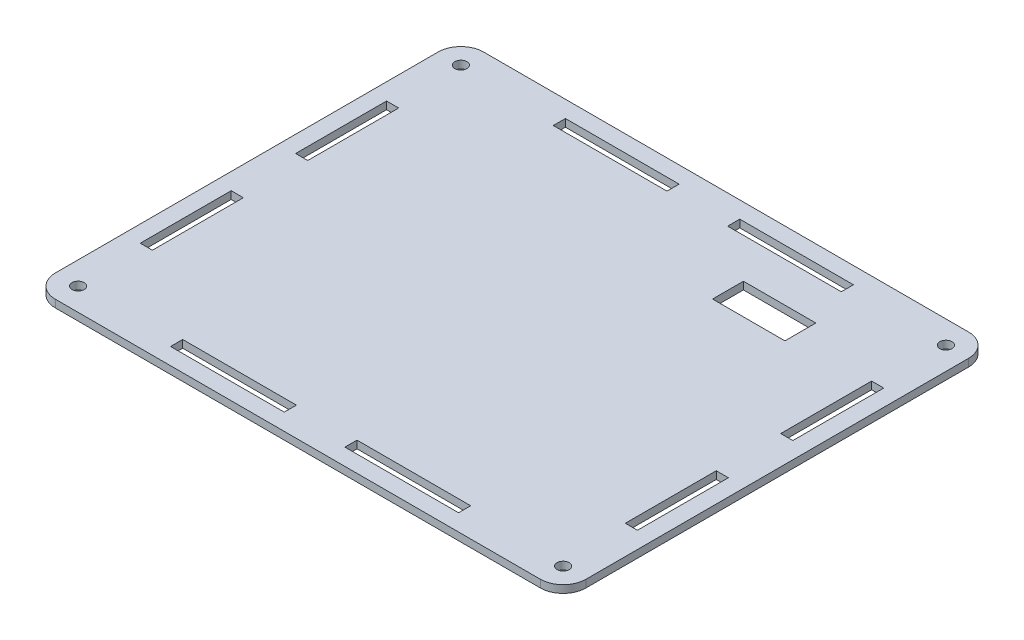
SolidWorks part; units mm, degrees
ref_plane "Front Plane" through (0, 0, 0) normal (0, 0, 1) x (1, 0, 0)
ref_plane "Top Plane" through (0, 0, 0) normal (0, 1, 0) x (1, 0, 0)
ref_plane "Right Plane" through (0, 0, 0) normal (1, 0, 0) x (0, 0, -1)
sketch "Sketch1" plane through (0, 0, 0) normal (0, 1, 0) x (1, 0, 0)
  line L0 (0, 0) -> (0, 50000) construction
  line L1 (0, 0) -> (140, 0)
  line L2 (0, 0) -> (0, 113)
  line L3 (0, 113) -> (140, 113)
  line L4 (140, 0) -> (140, 113)
  line L9 (140, 0) -> (140, 50000) construction
  line L10 (128, 0) -> (128, 50000) construction
  line L11 (66.2458, -26.4225) -> (66.2458, 49973.5775) construction
  line L12 (52.3371, 157.6359) -> (52.3371, -49842.3641) construction
  line L13 (12, -41.4903) -> (12, 49958.5097) construction
  line L14 (-38.7648, 12) -> (49961.2352, 12) construction
  line L15 (-49.8918, 101) -> (49950.1082, 101) construction
  line L16 (135.6, 24) -> (132.4, 24)
  line L17 (-84.1999, 52) -> (49915.8001, 52) construction
  line L18 (70, 148.2273) -> (70, -49851.7727) construction
  line L19 (32, 7.6) -> (62, 7.6)
  line L20 (32, 108.6) -> (62, 108.6)
  line L21 (32, 108.6) -> (32, 105.4)
  line L22 (32, 105.4) -> (62, 105.4)
  line L23 (62, 108.6) -> (62, 105.4)
  line L28 (32, 7.6) -> (32, 4.4)
  line L29 (32, 4.4) -> (62, 4.4)
  line L30 (62, 7.6) -> (62, 4.4)
  line L35 (108, 7.6) -> (108, 4.4)
  line L40 (4.4, 89) -> (7.6, 89)
  line L41 (4.4, 89) -> (4.4, 65)
  line L42 (4.4, 65) -> (7.6, 65)
  line L43 (7.6, 89) -> (7.6, 65)
  line L44 (4.4, 48) -> (7.6, 48)
  line L45 (4.4, 48) -> (4.4, 24)
  line L46 (4.4, 24) -> (7.6, 24)
  line L47 (7.6, 48) -> (7.6, 24)
  line L56 (108, 4.4) -> (78, 4.4)
  line L57 (78, 7.6) -> (78, 4.4)
  line L58 (108, 7.6) -> (78, 7.6)
  line L59 (108, 105.4) -> (78, 105.4)
  line L60 (78, 108.6) -> (78, 105.4)
  line L61 (108, 108.6) -> (78, 108.6)
  line L62 (108, 108.6) -> (108, 105.4)
  line L63 (132.4, 48) -> (132.4, 24)
  line L64 (135.6, 48) -> (132.4, 48)
  line L65 (135.6, 48) -> (135.6, 24)
  line L66 (135.6, 65) -> (132.4, 65)
  line L67 (132.4, 89) -> (132.4, 65)
  line L68 (135.6, 89) -> (132.4, 89)
  line L69 (135.6, 89) -> (135.6, 65)
  line L70 (-70.1779, 42) -> (49929.8221, 42) construction
  line L72 (111.77, 94.9) -> (92.67, 94.9)
  line L73 (111.77, 94.9) -> (111.77, 86.7503)
  line L74 (111.77, 86.7503) -> (92.67, 86.7503)
  line L75 (92.67, 94.9) -> (92.67, 86.7503)
  circle A7 centre (6, 107) radius 1.6
  circle A8 centre (134, 107) radius 1.6
  circle A9 centre (134, 6) radius 1.6
  circle A10 centre (6, 6) radius 1.6
  point P78 (32, 107)
  point P88 (32, 6)
  point P95 (6, 89)
  point P96 (6, 65)
  point P97 (6, 48)
  point P98 (6, 24)
  dimension "D16" = 8
  dimension "D22" = 30
  dimension "D26" = 19.1
  dimension "D28" = 18.1
  dimension "D1" = 113
  dimension "D2" = 140
  dimension "D6" = 12
  dimension "D7" = 12
  dimension "D8" = 12
  dimension "D9" = 12
  dimension "D10" = 6
  dimension "D11" = 6
  dimension "D12" = 6
  dimension "D13" = 6
  dimension "D15" = 70
  dimension "D17" = 8
  dimension "D18" = 12
  dimension "D19" = 12
  dimension "D20" = 17
  dimension "D23" = 49
  dimension "D25" = 8.1497
  dimension "D27" = 28.23
  dimension "D30" = 30
  dimension "D38" = 30
  dimension "D40" = 24
  dimension "D43" = 24
  dimension "D48" = 3.2
extrude "Boss-Extrude1" add sketch "Sketch1" along normal blind 2
fillet "Fillet1" radius 6 1 edges at (0, 1, -113)
fillet "Fillet2" radius 6 1 edges at (0, 1, 0)
fillet "Fillet3" radius 6 2 edges at (140, 1, -113) (140, 1, 0)
